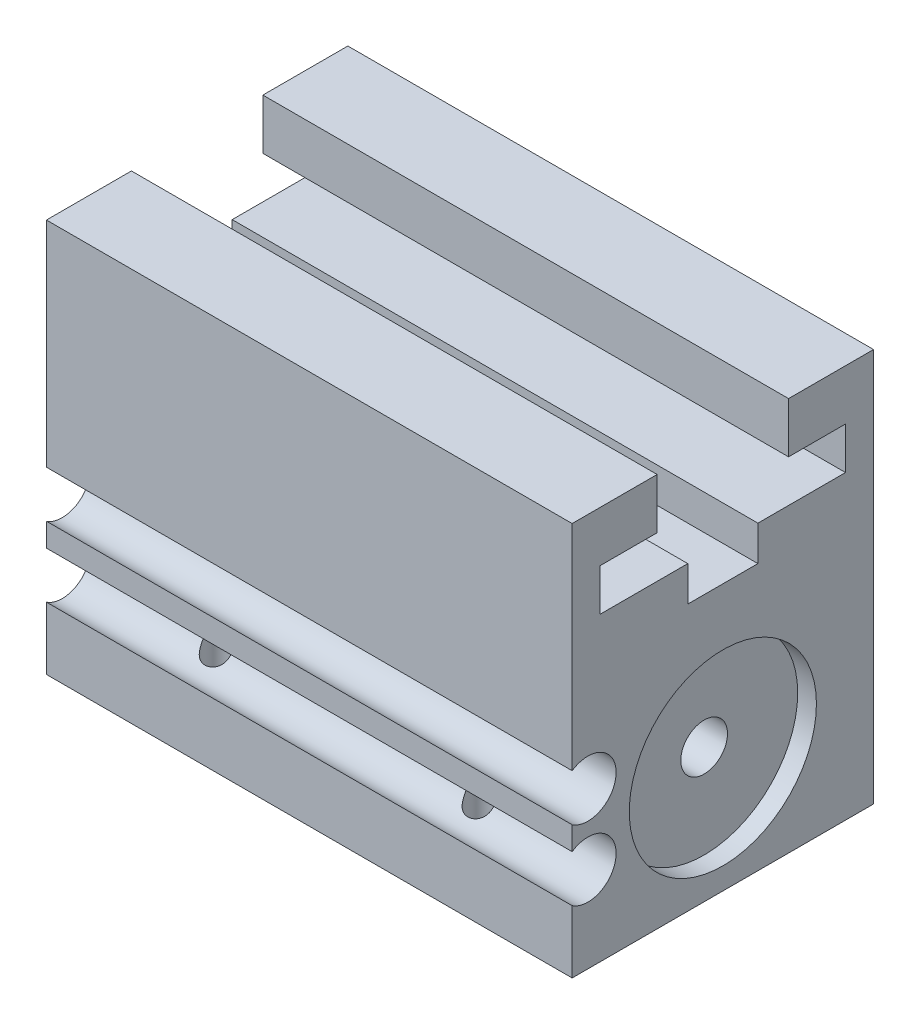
SolidWorks part; units mm, degrees
ref_plane "Front Plane" through (0, 0, 0) normal (0, 0, 1) x (1, 0, 0)
ref_plane "Top Plane" through (0, 0, 0) normal (0, 1, 0) x (1, 0, 0)
ref_plane "Right Plane" through (0, 0, 0) normal (1, 0, 0) x (0, 0, -1)
sketch "Sketch1" plane through (0, 0, 0) normal (1, 0, 0) x (0, 0, -1)
  line L0 (-10.922, -14.2621) -> (10.922, -14.2621)
  line L1 (10.922, -14.2621) -> (10.922, 14.2621)
  line L2 (10.922, 14.2621) -> (4.7625, 14.2621)
  line L3 (4.7625, 14.2621) -> (4.7625, 10.6045)
  line L4 (4.7625, 10.6045) -> (8.89, 10.6045)
  line L5 (8.89, 10.6045) -> (8.89, 7.5565)
  line L6 (8.89, 7.5565) -> (2.54, 7.5565)
  line L7 (2.54, 7.5565) -> (2.54, 5.0165)
  line L8 (2.54, 5.0165) -> (-2.54, 5.0165)
  line L9 (-2.54, 5.0165) -> (-2.54, 7.5565)
  line L10 (-2.54, 7.5565) -> (-8.89, 7.5565)
  line L11 (-8.89, 7.5565) -> (-8.89, 10.6045)
  line L12 (-8.89, 10.6045) -> (-4.7625, 10.6045)
  line L13 (-4.7625, 10.6045) -> (-4.7625, 14.2621)
  line L14 (-4.7625, 14.2621) -> (-10.922, 14.2621)
  line L15 (-10.922, 14.2621) -> (-10.922, -1.2523)
  line L16 (-10.922, -4.6431) -> (-10.922, -6.3323)
  line L17 (-10.922, -9.7231) -> (-10.922, -14.2621)
  arc A0 (-10.922, -1.2523) -> (-10.922, -4.6431) centre (-9.779, -2.9477) cw
  arc A1 (-10.922, -6.3323) -> (-10.922, -9.7231) centre (-9.779, -8.0277) cw
extrude "Extrude1" add sketch "Sketch1" along normal blind 38.1
ref_plane "Plane1" through (38.1, 0, 0) normal (1, 0, 0) x (0, 0, -1)
sketch "Sketch2" plane through (38.1, 0, 0) normal (1, 0, 0) x (0, 0, -1)
  circle A0 centre (0, -5.9055) radius 6.7818
extrude "Cut-Extrude1" cut sketch "Sketch2" against normal blind 1.3564
sketch "Sketch3" plane through (0, 0, 0) normal (1, 0, 0) x (0, 0, -1)
  circle A0 centre (8.7249, 4.4069) radius 1.2027
extrude "Cut-Extrude2" cut sketch "Sketch3" along normal blind 3.048
sketch "Sketch4" plane through (0, 0, 0) normal (1, 0, 0) x (0, 0, -1)
  circle A0 centre (-8.7249, -11.4681) radius 1.2027
extrude "Cut-Extrude3" cut sketch "Sketch4" along normal blind 3.048
ref_plane "Plane2" through (0, 0, 8.7249) normal (0, 0, 1) x (1, 0, 0)
sketch "Sketch5" plane through (0, 0, 8.7249) normal (0, 0, 1) x (1, 0, 0)
  line L0 (0, 4.4069) -> (0, 5.8039)
  line L1 (0, 5.8039) -> (0.381, 5.4229)
  line L2 (0.381, 5.4229) -> (6.2714, 5.4229)
  line L3 (6.2714, 5.4229) -> (6.858, 4.4069)
  line L4 (6.858, 4.4069) -> (0, 4.4069)
  line L5 (6.858, 4.4069) -> (0, 4.4069) construction
revolve "Cut-Revolve1" cut sketch "Sketch5" angle 360 about L5
ref_plane "Plane3" through (0, 0, -8.7249) normal (0, 0, 1) x (1, 0, 0)
sketch "Sketch6" plane through (0, 0, -8.7249) normal (0, 0, 1) x (1, 0, 0)
  line L0 (0, -11.4681) -> (0, -10.0711)
  line L1 (0, -10.0711) -> (0.381, -10.4521)
  line L2 (0.381, -10.4521) -> (6.2714, -10.4521)
  line L3 (6.2714, -10.4521) -> (6.858, -11.4681)
  line L4 (6.858, -11.4681) -> (0, -11.4681)
  line L5 (6.858, -11.4681) -> (0, -11.4681) construction
revolve "Cut-Revolve2" cut sketch "Sketch6" angle 360 about L5
ref_plane "Plane4" through (7.62, 0, 0) normal (1, 0, 0) x (0, 0, -1)
sketch "Sketch7" plane through (7.62, 0, 0) normal (1, 0, 0) x (0, 0, -1)
  line L0 (6.35, 1.5621) -> (6.35, 3.5052)
  line L1 (6.35, 3.5052) -> (10.4521, 3.5052)
  line L2 (10.4521, 3.5052) -> (10.922, 3.9751)
  line L3 (10.922, 3.9751) -> (10.922, 1.5621)
  line L4 (10.922, 1.5621) -> (6.35, 1.5621)
  line L5 (10.922, 1.5621) -> (6.35, 1.5621) construction
revolve "Cut-Revolve3" cut sketch "Sketch7" angle 360 about L5
ref_plane "Plane5" through (30.734, 0, 0) normal (1, 0, 0) x (0, 0, -1)
sketch "Sketch8" plane through (30.734, 0, 0) normal (1, 0, 0) x (0, 0, -1)
  line L0 (6.35, 1.5621) -> (6.35, 3.5052)
  line L1 (6.35, 3.5052) -> (10.4521, 3.5052)
  line L2 (10.4521, 3.5052) -> (10.922, 3.9751)
  line L3 (10.922, 3.9751) -> (10.922, 1.5621)
  line L4 (10.922, 1.5621) -> (6.35, 1.5621)
  line L5 (10.922, 1.5621) -> (6.35, 1.5621) construction
revolve "Cut-Revolve4" cut sketch "Sketch8" angle 360 about L5
sketch "Sketch9" plane through (0, 0, 0) normal (1, 0, 0) x (0, 0, -1)
  circle A0 centre (0, -5.9055) radius 6.7818
extrude "Cut-Extrude4" cut sketch "Sketch9" along normal blind 1.3564
ref_plane "Plane6" through (9.525, 0, 0) normal (1, 0, 0) x (0, 0, -1)
sketch "Sketch10" plane through (9.525, 0, 0) normal (1, 0, 0) x (0, 0, -1)
  line L0 (-7.9375, -14.2621) -> (-9.3345, -14.2621)
  line L1 (-9.3345, -14.2621) -> (-8.9535, -13.8811)
  line L2 (-8.9535, -13.8811) -> (-8.9535, -8.9051)
  line L3 (-8.9535, -8.9051) -> (-7.9375, -8.3185)
  line L4 (-7.9375, -8.3185) -> (-7.9375, -14.2621)
  line L5 (-7.9375, -8.3185) -> (-7.9375, -14.2621) construction
revolve "Cut-Revolve5" cut sketch "Sketch10" angle 360 about L5
ref_plane "Plane7" through (0, -14.2621, 0) normal (0, 1, 0) x (-1, 0, 0)
ref_plane "Plane8" through (28.575, 0, 0) normal (1, 0, 0) x (0, 0, -1)
ref_plane "Plane9" through (28.575, 0, 0) normal (1, 0, 0) x (0, 0, -1)
ref_plane "Plane10" through (9.525, 0, 0) normal (1, 0, 0) x (0, 0, -1)
sketch "Sketch11" plane through (28.575, 0, 0) normal (1, 0, 0) x (0, 0, -1)
  line L0 (-7.9375, -14.2621) -> (-9.3345, -14.2621)
  line L1 (-9.3345, -14.2621) -> (-8.9535, -13.8811)
  line L2 (-8.9535, -13.8811) -> (-8.9535, -8.9051)
  line L3 (-8.9535, -8.9051) -> (-7.9375, -8.3185)
  line L4 (-7.9375, -8.3185) -> (-7.9375, -14.2621)
  line L5 (-7.9375, -8.3185) -> (-7.9375, -14.2621) construction
sketch "Sketch12" plane through (28.575, 0, 0) normal (1, 0, 0) x (0, 0, -1)
  line L0 (7.9375, -14.2621) -> (6.5405, -14.2621)
  line L1 (6.5405, -14.2621) -> (6.9215, -13.8811)
  line L2 (6.9215, -13.8811) -> (6.9215, -8.9051)
  line L3 (6.9215, -8.9051) -> (7.9375, -8.3185)
  line L4 (7.9375, -8.3185) -> (7.9375, -14.2621)
  line L5 (7.9375, -8.3185) -> (7.9375, -14.2621) construction
sketch "Sketch13" plane through (9.525, 0, 0) normal (1, 0, 0) x (0, 0, -1)
  line L0 (7.9375, -14.2621) -> (6.5405, -14.2621)
  line L1 (6.5405, -14.2621) -> (6.9215, -13.8811)
  line L2 (6.9215, -13.8811) -> (6.9215, -8.9051)
  line L3 (6.9215, -8.9051) -> (7.9375, -8.3185)
  line L4 (7.9375, -8.3185) -> (7.9375, -14.2621)
  line L5 (7.9375, -8.3185) -> (7.9375, -14.2621) construction
revolve "Cut-Revolve6" cut sketch "Sketch11" angle 360 about L5
revolve "Cut-Revolve7" cut sketch "Sketch12" angle 360 about L5
revolve "Cut-Revolve8" cut sketch "Sketch13" angle 360 about L5
sketch "Sketch14" plane through (0, -14.2621, 0) normal (0, 1, 0) x (-1, 0, 0)
  circle A0 centre (-15.875, 7.9375) radius 1.2027
extrude "Cut-Extrude5" cut sketch "Sketch14" along normal blind 3.175
sketch "Sketch15" plane through (0, -14.2621, 0) normal (0, 1, 0) x (-1, 0, 0)
  circle A0 centre (-22.225, -7.9375) radius 1.2027
extrude "Cut-Extrude6" cut sketch "Sketch15" along normal blind 3.175
sketch "Sketch16" plane through (0, 0, 0) normal (0, 0, 1) x (1, 0, 0)
  line L0 (0, 2.8194) -> (0, 4.8514)
  line L1 (0, 4.8514) -> (0.381, 4.4704)
  line L2 (0.381, 4.4704) -> (3.048, 4.4704)
  line L3 (3.048, 4.4704) -> (3.048, 2.8194)
  line L4 (3.048, 2.8194) -> (0, 2.8194)
  line L5 (3.048, 2.8194) -> (0, 2.8194) construction
revolve "Cut-Revolve9" cut sketch "Sketch16" angle 360 about L5
sketch "Sketch17" plane through (0, 0, 0) normal (0, 0, 1) x (1, 0, 0)
  line L0 (6.2636, -5.9055) -> (6.2636, -4.21)
  line L1 (6.2636, -4.21) -> (36.7436, -4.21)
  line L2 (36.7436, -4.21) -> (36.7436, -5.9055)
  line L3 (36.7436, -5.9055) -> (6.2636, -5.9055)
  line L4 (36.7436, -5.9055) -> (6.2636, -5.9055) construction
revolve "Cut-Revolve10" cut sketch "Sketch17" angle 360 about L4
ref_plane "Plane11" through (38.1254, 0, 0) normal (1, 0, 0) x (0, 0, -1)
ref_plane "Plane12" through (38.1, 0, 0) normal (1, 0, 0) x (0, 0, -1)
ref_plane "Plane13" through (38.1, 0, 0) normal (1, 0, 0) x (0, 0, -1)
ref_plane "Plane14" through (25.5016, 0, 0) normal (1, 0, 0) x (0, 0, -1)
